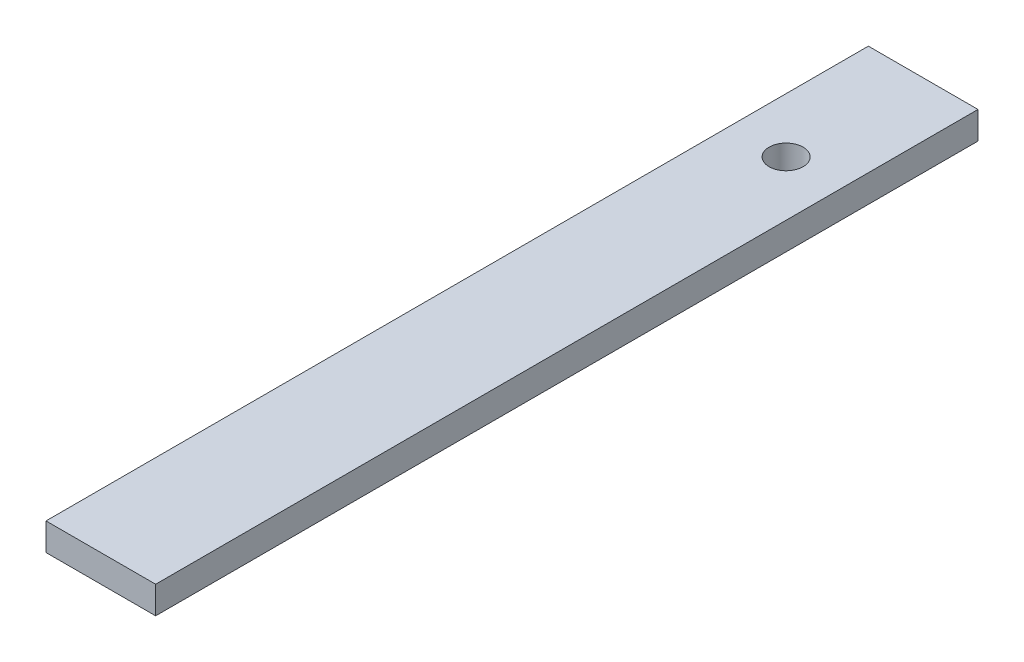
SolidWorks part; units mm, degrees
ref_plane "Front Plane" through (0, 0, 0) normal (0, 0, 1) x (1, 0, 0)
ref_plane "Top Plane" through (0, 0, 0) normal (0, 1, 0) x (1, 0, 0)
ref_plane "Right Plane" through (0, 0, 0) normal (1, 0, 0) x (0, 0, -1)
sketch "Sketch1" plane through (0, 0, 0) normal (0, 1, 0) x (1, 0, 0)
  line L0 (0, 0) -> (50.8, 0)
  line L1 (0, 0) -> (0, 381)
  line L2 (50.8, 0) -> (50.8, 381)
  line L3 (0, 381) -> (50.8, 381)
  line L4 (25.4, 381) -> (25.4, 0) construction
  circle A0 centre (25.4, 317.5) radius 7.874
  dimension "D3" = 15.748
  dimension "D4" = 63.5
  dimension "D1" = 50.8
  dimension "D2" = 381
extrude "Boss-Extrude1" add sketch "Sketch1" along normal blind 12.7
ref_plane "Plane1" through (25.4, 0, 0) normal (-1, 0, 0) x (0, 0, 1)
